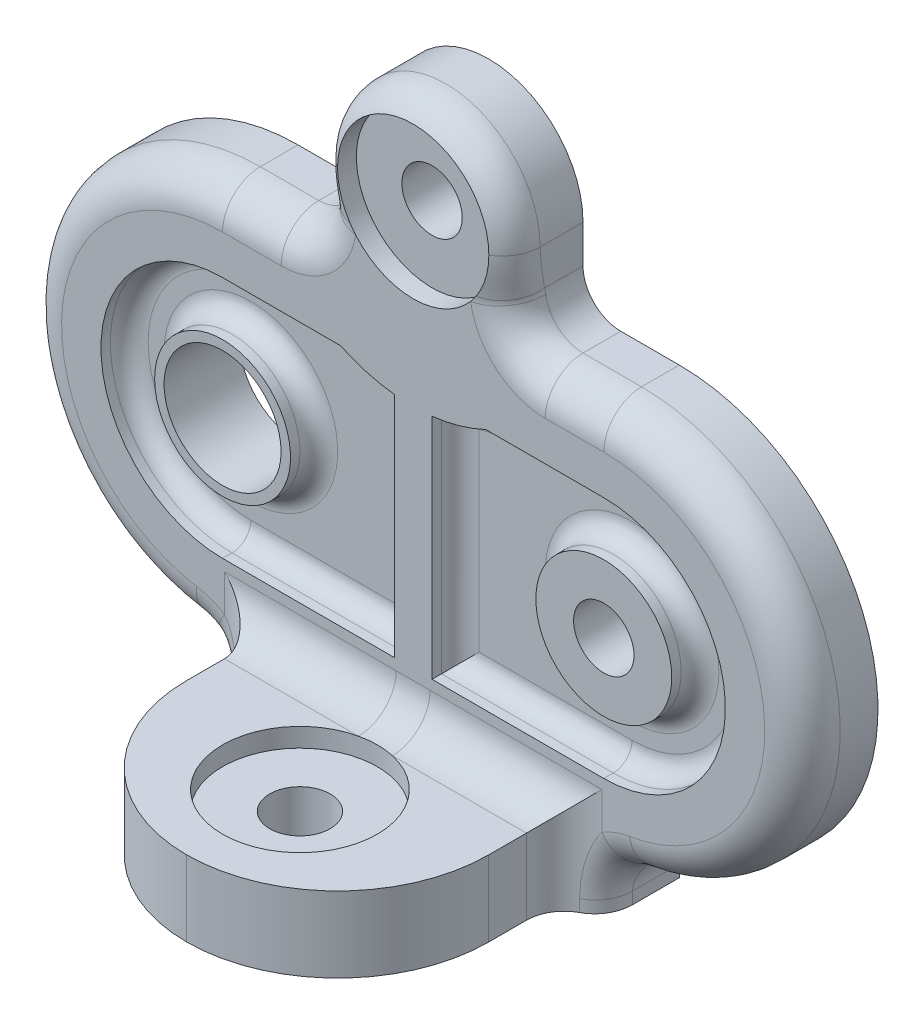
SolidWorks part; units mm, degrees
ref_plane "Plan de face" through (0, 0, 0) normal (0, 0, 1) x (1, 0, 0)
ref_plane "Plan de dessus" through (0, 0, 0) normal (0, 1, 0) x (1, 0, 0)
ref_plane "Plan de droite" through (0, 0, 0) normal (1, 0, 0) x (0, 0, -1)
sketch "Esquisse1" plane through (0, 0, 0) normal (0, 0, 1) x (1, 0, 0)
  line L0 (0, -27.1129) -> (0, 59.6143) construction
  line L1 (-37.8012, 0) -> (37.8221, 0) construction
  line L2 (10.1, -9.7911) -> (10.1, 18.9396) construction
  line L3 (-10.1, -17.307) -> (-10.1, 18.9396) construction
  line L4 (37.8221, 10.53) -> (-28.4878, 10.53) construction
  line L5 (37.8221, -13) -> (-21.8797, -13) construction
  line L6 (31.1591, -9) -> (-15.3674, -9) construction
  line L7 (-10.1, -12.3694) -> (-10.1, -13)
  line L8 (10.1, -12.3694) -> (10.1, -13)
  line L9 (-10.1, 10.53) -> (-7, 10.53)
  line L10 (-10.1, -13) -> (10.1, -13)
  line L11 (7, 10.53) -> (10.1, 10.53)
  line L12 (37.8221, 14.53) -> (-8.5015, 14.53) construction
  line L13 (5, 14.53) -> (5, 12.53)
  line L14 (-5, 14.53) -> (-5, 12.53)
  circle A0 centre (10.1, 0) radius 1.6
  circle A1 centre (-10.1, 0) radius 3.1
  circle A2 centre (10.1, 0) radius 10.8 construction
  circle A3 centre (-10.1, 0) radius 10.8 construction
  arc A4 (10.1, 10.53) -> (11.7808, -10.395) centre (10.1, 0) cw
  arc A5 (-10.1, 10.53) -> (-11.7808, -10.395) centre (-10.1, 0) ccw
  arc A6 (11.7808, -10.395) -> (10.1, -12.3694) centre (12.1, -12.3694) ccw
  arc A7 (-10.1, -12.3694) -> (-11.7808, -10.395) centre (-12.1, -12.3694) ccw
  arc A8 (-5, 12.53) -> (-7, 10.53) centre (-7, 12.53) cw
  circle A9 centre (0, 14.53) radius 1.6
  arc A10 (5, 14.53) -> (-5, 14.53) centre (0, 14.53) ccw
  arc A11 (5, 12.53) -> (7, 10.53) centre (7, 12.53) ccw
  point P29 (10.1, -10.53)
  point P32 (-10.1, -10.53)
  point P40 (-5, 10.53)
  point P46 (5, 10.53)
  dimension "D3" = 13
  dimension "D4" = 4
  dimension "D6" = 2
  dimension "D7" = 2
  dimension "D1" = 10.1
  dimension "D2" = 10.1
  dimension "D5" = 10.53
  dimension "D8" = 4
extrude "Boss.-Extru.1" add sketch "Esquisse1" along normal blind 4
sketch "Esquisse2" plane through (0, 0, 4) normal (0, 0, 1) x (1, 0, 0)
  line L0 (0, -20.8278) -> (0, -6.8042) construction
  line L1 (12.9107, -13) -> (-27.1311, -13) construction
  line L2 (-27.1311, -9) -> (5.5111, -9) construction
  line L3 (-8, -20.8278) -> (-8, 0.5955) construction
  line L4 (-6, -15.5167) -> (-6, 0.5955) construction
  line L5 (-8, -9) -> (-8, -13)
  line L6 (8, -9) -> (8, -13)
  line L7 (-8, -13) -> (8, -13)
  line L8 (-8, -9) -> (8, -9)
  dimension "D1" = 4
  dimension "D2" = 8
  dimension "D3" = 2
extrude "Boss.-Extru.2" add sketch "Esquisse2" along normal blind 12
sketch "Esquisse3" plane through (0, -9, 0) normal (0, 1, 0) x (1, 0, 0)
  line L0 (14.7606, -10) -> (-5.7675, -10) construction
  line L1 (0, -20.9092) -> (0, -7.184) construction
  circle A0 centre (0, -10) radius 1.6
extrude "Enlèv. mat.-Extru.1" cut sketch "Esquisse3" against normal blind 4
sketch "Esquisse4" plane through (0, -9, 0) normal (0, 1, 0) x (1, 0, 0)
  circle A0 centre (0, -10) radius 4.1
extrude "Enlèv. mat.-Extru.2" cut sketch "Esquisse4" against normal blind 1
fillet "Congé1" radius 2 3 edges at (0, -9, 4)
fillet "Congé2" radius 8 2 edges at (8, -11, 16) (-8, -11, 16)
sketch "Esquisse5" plane through (0, 0, 4) normal (0, 0, 1) x (1, 0, 0)
  line L0 (0, 13.2837) -> (0, -15.2928) construction
  line L1 (10.1, 6.443) -> (3.8461, 6.443)
  line L2 (10.1, -6.443) -> (1, -6.443)
  line L3 (-10.1, -6.443) -> (-1, -6.443)
  line L4 (1, 5.631) -> (1, -6.443)
  line L5 (-10.1, 6.443) -> (-3.8461, 6.443)
  line L6 (-1, 5.631) -> (-1, -6.443)
  circle A0 centre (10.1, 0) radius 3.6
  arc A1 (10.1, -6.443) -> (10.1, 6.443) centre (10.1, 0) ccw
  arc A2 (1, 5.631) -> (3.8461, 6.443) centre (0, 14.53) ccw
  circle A3 centre (-10.1, 0) radius 3.6
  arc A4 (-10.1, -6.443) -> (-10.1, 6.443) centre (-10.1, 0) cw
  arc A5 (-1, 5.631) -> (-3.8461, 6.443) centre (0, 14.53) cw
  dimension "D1" = 1
extrude "Enlèv. mat.-Extru.3" cut sketch "Esquisse5" against normal blind 1.5
sketch "Esquisse6" plane through (0, 0, 4) normal (0, 0, 1) x (1, 0, 0)
  circle A0 centre (0, 14.53) radius 4.01
extrude "Enlèv. mat.-Extru.4" cut sketch "Esquisse6" against normal blind 1
fillet "Congé3" radius 2 10 edges at (10.1, -12.6847, 4) (10.5771, -11.0729, 4) (20.5962, 0.8431, 4) (8.55, 10.53, 4) (-8.55, 10.53, 4) (-10.1, -12.6847, 4) (-10.5771, -11.0729, 4) (-20.5962, 0.8431, 4) (5.5858, 11.1158, 4) (-5.5858, 11.1158, 4)
fillet "Congé4" radius 1 12 edges at (-6.973, 6.443, 2.5) (-16.543, 0, 2.5) (6.973, 6.443, 2.5) (16.543, 0, 2.5) (-2.4568, 5.9186, 2.5) (2.4568, 5.9186, 2.5) (1, -0.406, 2.5) (-1, -0.406, 2.5) (-13.7, 0, 2.5) (-5.55, -6.443, 2.5) (13.7, 0, 2.5) (5.55, -6.443, 2.5)
